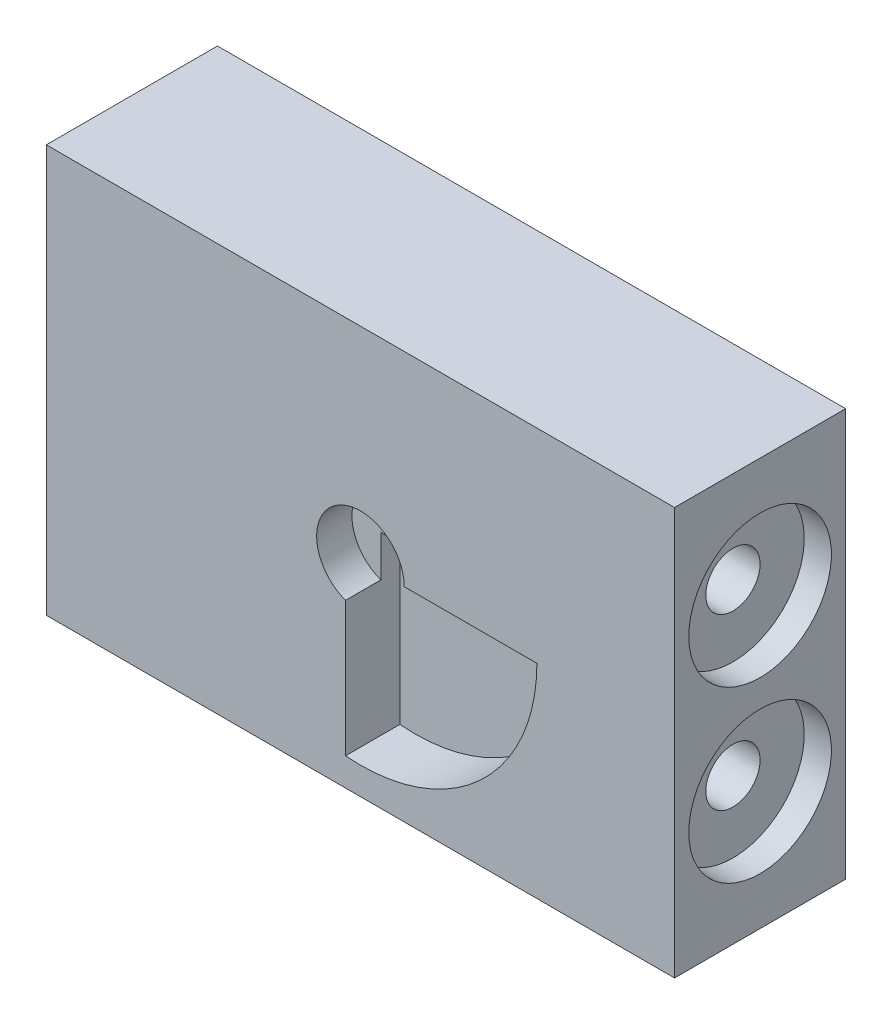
SolidWorks part; units mm, degrees
ref_plane "Front" through (0, 0, 0) normal (0, 0, 1) x (1, 0, 0)
ref_plane "Top" through (0, 0, 0) normal (0, 1, 0) x (1, 0, 0)
ref_plane "Right" through (0, 0, 0) normal (1, 0, 0) x (0, 0, -1)
imported_body "Imported1"
sketch "Sketch1" plane through (0, 0, 16.002) normal (0, 0, 1) x (1, 0, 0)
  line L0 (-2.794, 0) -> (33.0004, 0)
  line L1 (-2.794, 0) -> (-2.794, -32.8819)
  arc A0 (-2.794, -32.8819) -> (33.0004, 0) centre (0, 0) ccw
  circle A1 centre (0, 0) radius 8.1915 construction
  dimension "D1" = 2.794
extrude "Cut-Extrude1" cut sketch "Sketch1" against normal blind 10.16
sketch "Sketch2" plane through (0, 0, 16.002) normal (0, 0, 1) x (1, 0, 0)
  line L0 (0, 0) -> (0, 33.0004)
  line L1 (0, 0) -> (33.0004, 0)
  arc A0 (33.0004, 0) -> (0, 33.0004) centre (0, 0) ccw
  arc A1 (-2.794, -32.8819) -> (33.0004, 0) centre (0, 0) ccw construction
extrude "Cut-Extrude2" [suppressed] cut sketch "Sketch2" against normal blind 10.16
